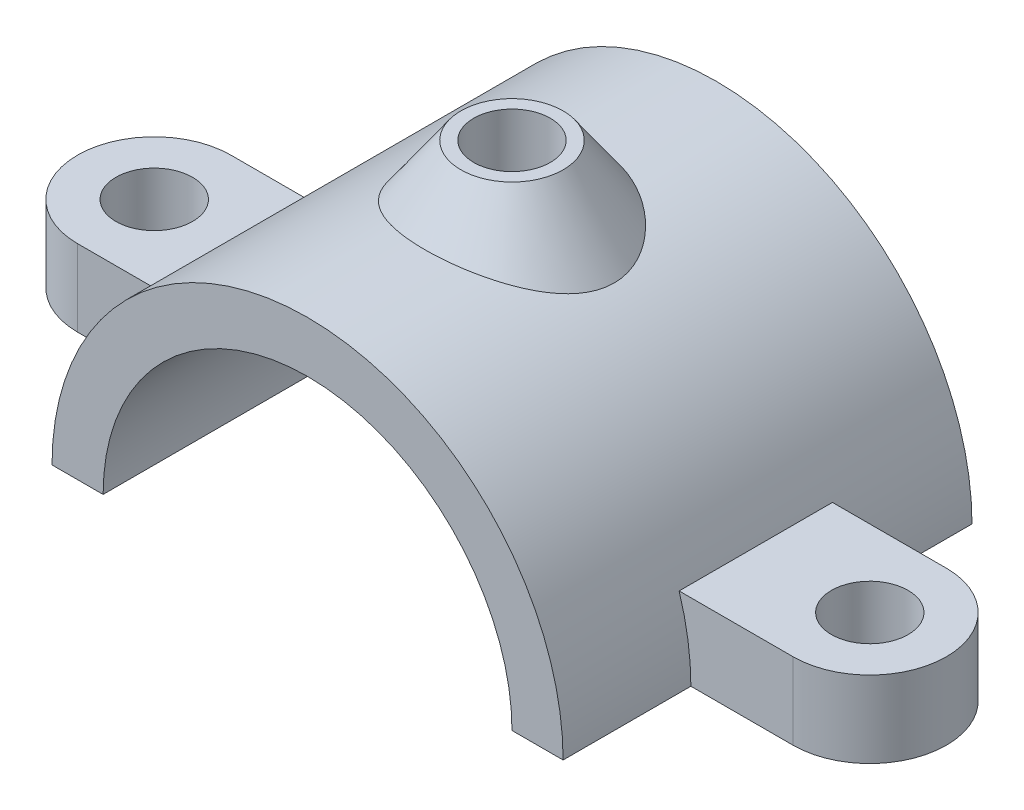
SolidWorks part; units mm, degrees
ref_plane "前视基准面" through (0, 0, 0) normal (0, 0, 1) x (1, 0, 0)
ref_plane "上视基准面" through (0, 0, 0) normal (0, 1, 0) x (1, 0, 0)
ref_plane "右视基准面" through (0, 0, 0) normal (1, 0, 0) x (0, 0, -1)
sketch "Sketch1" plane through (0, 0, 0) normal (0, 0, 1) x (1, 0, 0)
  line L0 (-75.0687, 0) -> (65.4342, 0) construction
  line L1 (50, 0) -> (40, 0)
  line L2 (-40, 0) -> (-50, 0)
  arc A0 (-50, 0) -> (50, 0) centre (0, 0) cw
  arc A1 (-40, 0) -> (40, 0) centre (0, 0) cw
  dimension "D1" = 40
  dimension "D2" = 50
extrude "Extrude1" add sketch "Sketch1" along normal mid plane 80
sketch "草图1" plane through (0, 0, 0) normal (0, 0, 1) x (1, 0, 0)
  line L0 (0, 0) -> (0, 66.8263) construction
  line L1 (0, 60) -> (-10, 60)
  line L2 (-10, 60) -> (-20, 45.8258)
  line L3 (0, 60) -> (0, 50)
  arc A0 (50, 0) -> (-50, 0) centre (0, 0) ccw construction
  arc A1 (-20, 45.8258) -> (0, 50) centre (0, 0) cw
  dimension "D1" = 60
  dimension "D2" = 10
  dimension "D3" = 20
revolve "旋转1" add sketch "草图1" angle 360 about L0
sketch "草图2" plane through (0, 60, 0) normal (0, 1, 0) x (1, 0, 0)
  circle A0 centre (0, 0) radius 7.5
  dimension "D1" = 15
extrude "切除-拉伸1" cut sketch "草图2" against normal through all
sketch "草图3" plane through (0, 0, 0) normal (0, -1, 0) x (1, 0, 0)
  line L0 (-83.9659, 0) -> (73.3417, 0) construction
  line L1 (40, 15) -> (40, -15)
  line L2 (40, -15) -> (70, -15)
  line L3 (70, 15) -> (40, 15)
  arc A0 (70, -15) -> (70, 15) centre (70, 0) ccw
  circle A1 centre (70, 0) radius 7.5
  dimension "D2" = 15
  dimension "D4" = 15
  dimension "D1" = 70
  dimension "D3" = 30
extrude "拉伸1" add sketch "草图3" against normal blind 15
mirror "镜向1" about plane through (0, 0, 0) normal (1, 0, 0) of "拉伸1"
